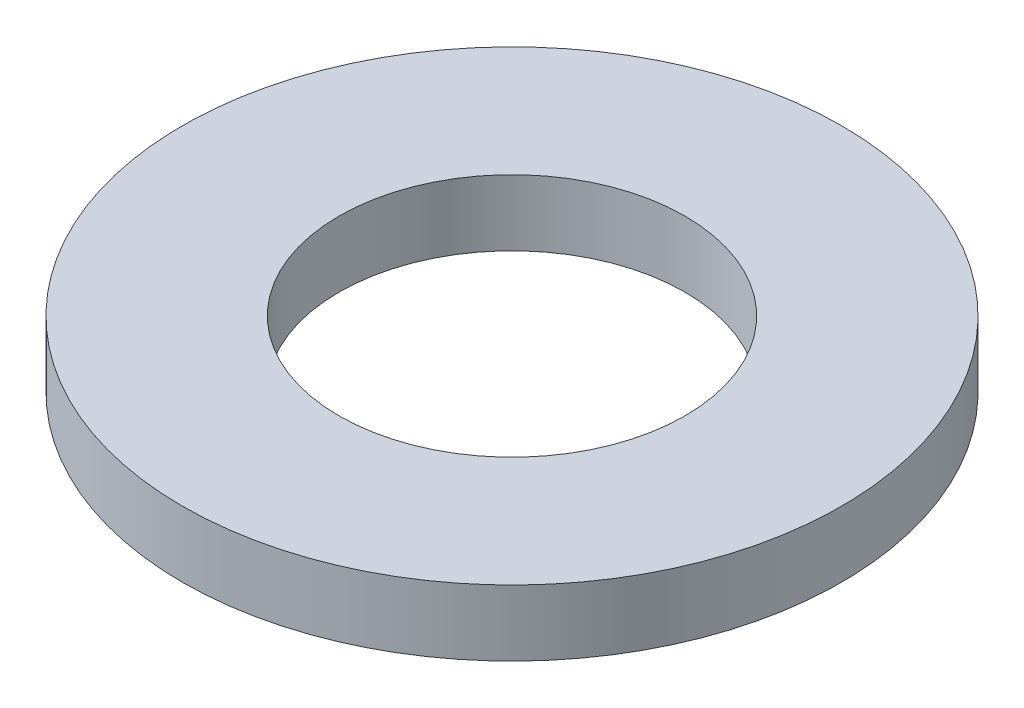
SolidWorks part; units mm, degrees
ref_plane "Plan1" through (0, 0, 0) normal (0, 0, 1) x (1, 0, 0)
ref_plane "Plan2" through (0, 0, 0) normal (0, 1, 0) x (1, 0, 0)
ref_plane "Plan3" through (0, 0, 0) normal (1, 0, 0) x (0, 0, -1)
sketch "Esquisse1" plane through (0, 0, 0) normal (0, 0, 1) x (1, 0, 0)
  line L1 (0, 0) -> (0, 2.5443) construction
  line L2 (5.25, 0) -> (5.25, 2)
  line L3 (5.25, 0) -> (10, 0)
  line L4 (10, 0) -> (10, 2)
  line L5 (10, 2) -> (5.25, 2)
  line L6 (5.25, 0) -> (-5.25, 0) construction
  line L7 (10, 0) -> (-10, 0) construction
  point P8 (0, 0)
revolve "Base-Révolution" add sketch "Esquisse1" angle 360 about L1
equation "\"Rext@Esquisse1\"=\"Diamètre extérieur@Esquisse1\"/2"
equation "\"Rint@Esquisse1\" = \"Diamètre de passage@Esquisse1\"/2"
